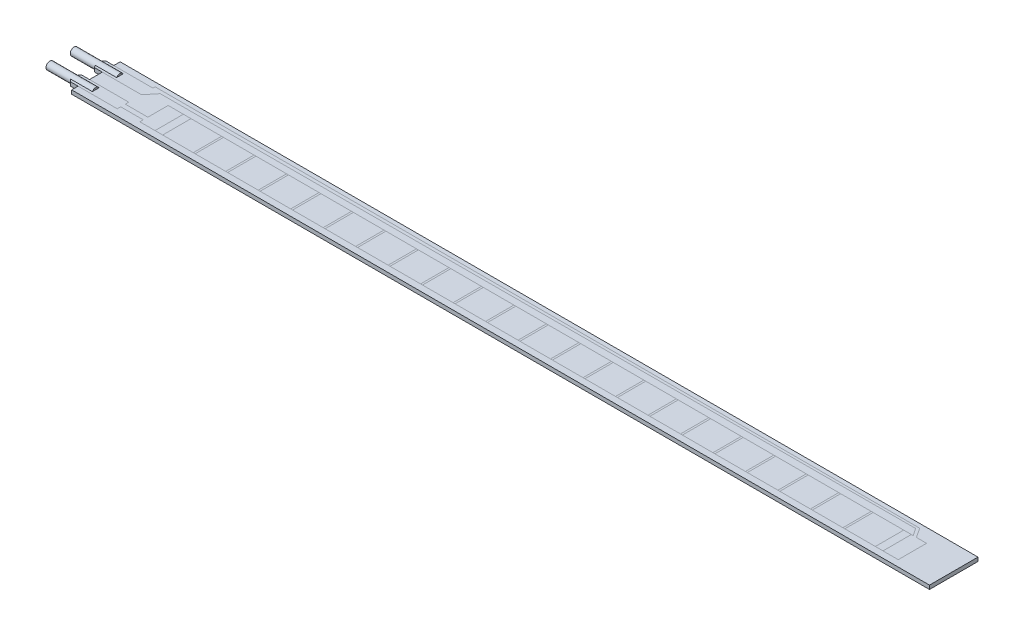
SolidWorks part; units mm, degrees
ref_plane "Front Plane" through (0, 0, 0) normal (0, 0, 1) x (1, 0, 0)
ref_plane "Top Plane" through (0, 0, 0) normal (0, 1, 0) x (1, 0, 0)
ref_plane "Right Plane" through (0, 0, 0) normal (1, 0, 0) x (0, 0, -1)
sketch "Sketch1" plane through (0, 0, 0) normal (0, 1, 0) x (1, 0, 0)
  line L1 (-56.12, -3.175) -> (56.12, -3.175)
  line L2 (-56.12, -3.175) -> (-56.12, 3.175)
  line L3 (-56.12, 3.175) -> (56.12, 3.175)
  line L4 (56.12, -3.175) -> (56.12, 3.175)
  point P0 (0, 0)
  dimension "D1" = 112.24
  dimension "D2" = 6.35
extrude "Boss-Extrude1" add sketch "Sketch1" along normal blind 0.5
sketch "Sketch2" plane through (0, 0.5, 0) normal (0, 1, 0) x (1, 0, 0)
  line L0 (-56.12, 0) -> (-56.12, -3.175) construction
  line L1 (-56.12, 3.175) -> (-56.12, -3.175) construction
  line L2 (-56.12, 0) -> (-56.12, 3.175) construction
  line L3 (-56.12, -2.3375) -> (-50.9922, -2.3375)
  line L4 (-48.0377, -1.2875) -> (-48.0377, 1.3707)
  line L6 (-56.12, -0.8375) -> (-50.9922, -0.8375)
  line L7 (-56.12, 0.8375) -> (-50.9922, 0.8375)
  line L8 (-56.12, 2.3375) -> (-50.9922, 2.3375)
  line L9 (-48.0377, -2.3375) -> (51.1928, -2.3375)
  line L10 (-48.0377, -2.3375) -> (-48.0377, -1.8875)
  line L11 (-48.0377, 1.3707) -> (49.452, 1.3707)
  line L12 (51.1928, -2.3375) -> (51.1928, 1.3707)
  line L13 (-50.9922, 0.8375) -> (-49.8989, 2.1837)
  line L14 (-50.9922, 2.3375) -> (-50.9922, 2.6295)
  line L15 (-50.9922, -1.8875) -> (-48.0377, -1.8875)
  line L16 (-50.9922, -1.2875) -> (-48.0377, -1.2875)
  line L17 (-50.9922, -0.8375) -> (-50.9922, -1.2875)
  line L18 (-50.9922, -2.3375) -> (-50.9922, -1.8875)
  line L19 (-50.9922, 2.6295) -> (49.0295, 2.6295)
  line L21 (49.0295, 2.6295) -> (49.8745, 1.3707)
  line L22 (-49.8989, 2.1837) -> (48.803, 2.3375)
  line L23 (48.803, 2.3375) -> (49.452, 1.3707)
  line L24 (49.8745, 1.3707) -> (51.1928, 1.3707)
  line L26 (-46.0475, -2.3375) -> (49.2025, -2.3375)
  line L27 (-46.0475, -2.3375) -> (-46.0475, 1.3707)
  line L28 (-46.0475, 1.3707) -> (49.2025, 1.3707)
  line L29 (49.2025, -2.3375) -> (49.2025, 1.3707)
  point P26 (1.5775, -0.4834)
  dimension "D3" = 95.25
sketch "Sketch3" plane through (0, 0.5, 0) normal (0, 1, 0) x (1, 0, 0)
  line L0 (-45.0475, 1.3707) -> (-45.0475, -2.3375)
  line L1 (49.2025, 1.3707) -> (-46.0475, 1.3707) construction
  line L2 (-46.0475, -2.3375) -> (49.2025, -2.3375) construction
  line L3 (48.2025, 1.3707) -> (48.2025, -2.3375)
  line L4 (-46.0475, 1.3707) -> (-46.0475, -2.3375) construction
  line L5 (49.2025, -2.3375) -> (49.2025, 1.3707) construction
  dimension "D1" = 1
  dimension "D2" = 1
sketch "Sketch4" plane through (0, 0.5, 0) normal (0, 1, 0) x (1, 0, 0)
  line L0 (-45.0475, -2.3375) -> (48.2025, -2.3375) construction
  line L1 (-45.0475, 1.3707) -> (-41.0475, 1.3707)
  line L2 (-45.0475, 1.3707) -> (-45.0475, -2.3375)
  line L3 (-45.0475, -2.3375) -> (-41.0475, -2.3375)
  line L4 (-41.0475, 1.3707) -> (-41.0475, -2.3375)
  line L11 (-40.7975, 1.3707) -> (-36.7975, 1.3707)
  line L12 (-40.7975, 1.3707) -> (-40.7975, -2.3375)
  line L17 (-40.7975, -2.3375) -> (-36.7975, -2.3375)
  line L18 (-36.7975, 1.3707) -> (-36.7975, -2.3375)
  line L29 (-36.5475, 1.3707) -> (-32.5475, 1.3707)
  line L30 (-36.5475, 1.3707) -> (-36.5475, -2.3375)
  line L35 (-36.5475, -2.3375) -> (-32.5475, -2.3375)
  line L36 (-32.5475, 1.3707) -> (-32.5475, -2.3375)
  line L47 (-32.2975, 1.3707) -> (-28.2975, 1.3707)
  line L48 (-32.2975, 1.3707) -> (-32.2975, -2.3375)
  line L53 (-32.2975, -2.3375) -> (-28.2975, -2.3375)
  line L54 (-28.2975, 1.3707) -> (-28.2975, -2.3375)
  line L65 (-28.0475, 1.3707) -> (-24.0475, 1.3707)
  line L66 (-28.0475, 1.3707) -> (-28.0475, -2.3375)
  line L71 (-28.0475, -2.3375) -> (-24.0475, -2.3375)
  line L72 (-24.0475, 1.3707) -> (-24.0475, -2.3375)
  line L83 (-23.7975, 1.3707) -> (-19.7975, 1.3707)
  line L84 (-23.7975, 1.3707) -> (-23.7975, -2.3375)
  line L89 (-23.7975, -2.3375) -> (-19.7975, -2.3375)
  line L90 (-19.7975, 1.3707) -> (-19.7975, -2.3375)
  line L101 (-19.5475, 1.3707) -> (-15.5475, 1.3707)
  line L102 (-19.5475, 1.3707) -> (-19.5475, -2.3375)
  line L107 (-19.5475, -2.3375) -> (-15.5475, -2.3375)
  line L108 (-15.5475, 1.3707) -> (-15.5475, -2.3375)
  line L119 (-15.2975, 1.3707) -> (-11.2975, 1.3707)
  line L120 (-15.2975, 1.3707) -> (-15.2975, -2.3375)
  line L125 (-15.2975, -2.3375) -> (-11.2975, -2.3375)
  line L126 (-11.2975, 1.3707) -> (-11.2975, -2.3375)
  line L133 (-11.0475, 1.3707) -> (-7.0475, 1.3707)
  line L134 (-11.0475, 1.3707) -> (-11.0475, -2.3375)
  line L135 (-11.0475, -2.3375) -> (-7.0475, -2.3375)
  line L136 (-7.0475, 1.3707) -> (-7.0475, -2.3375)
  line L139 (-6.7975, 1.3707) -> (-2.7975, 1.3707)
  line L140 (-6.7975, 1.3707) -> (-6.7975, -2.3375)
  line L141 (-6.7975, -2.3375) -> (-2.7975, -2.3375)
  line L142 (-2.7975, 1.3707) -> (-2.7975, -2.3375)
  line L145 (-2.5475, 1.3707) -> (1.4525, 1.3707)
  line L146 (-2.5475, 1.3707) -> (-2.5475, -2.3375)
  line L147 (-2.5475, -2.3375) -> (1.4525, -2.3375)
  line L148 (1.4525, 1.3707) -> (1.4525, -2.3375)
  line L151 (1.7025, 1.3707) -> (5.7025, 1.3707)
  line L152 (1.7025, 1.3707) -> (1.7025, -2.3375)
  line L153 (1.7025, -2.3375) -> (5.7025, -2.3375)
  line L154 (5.7025, 1.3707) -> (5.7025, -2.3375)
  line L157 (5.9525, 1.3707) -> (9.9525, 1.3707)
  line L158 (5.9525, 1.3707) -> (5.9525, -2.3375)
  line L159 (5.9525, -2.3375) -> (9.9525, -2.3375)
  line L160 (9.9525, 1.3707) -> (9.9525, -2.3375)
  line L163 (10.2025, 1.3707) -> (14.2025, 1.3707)
  line L164 (10.2025, 1.3707) -> (10.2025, -2.3375)
  line L165 (10.2025, -2.3375) -> (14.2025, -2.3375)
  line L166 (14.2025, 1.3707) -> (14.2025, -2.3375)
  line L169 (14.4525, 1.3707) -> (18.4525, 1.3707)
  line L170 (14.4525, 1.3707) -> (14.4525, -2.3375)
  line L171 (14.4525, -2.3375) -> (18.4525, -2.3375)
  line L172 (18.4525, 1.3707) -> (18.4525, -2.3375)
  line L175 (18.7025, 1.3707) -> (22.7025, 1.3707)
  line L176 (18.7025, 1.3707) -> (18.7025, -2.3375)
  line L177 (18.7025, -2.3375) -> (22.7025, -2.3375)
  line L178 (22.7025, 1.3707) -> (22.7025, -2.3375)
  line L181 (22.9525, 1.3707) -> (26.9525, 1.3707)
  line L182 (22.9525, 1.3707) -> (22.9525, -2.3375)
  line L183 (22.9525, -2.3375) -> (26.9525, -2.3375)
  line L184 (26.9525, 1.3707) -> (26.9525, -2.3375)
  line L187 (27.2025, 1.3707) -> (31.2025, 1.3707)
  line L188 (27.2025, 1.3707) -> (27.2025, -2.3375)
  line L189 (27.2025, -2.3375) -> (31.2025, -2.3375)
  line L190 (31.2025, 1.3707) -> (31.2025, -2.3375)
  line L193 (31.4525, 1.3707) -> (35.4525, 1.3707)
  line L194 (31.4525, 1.3707) -> (31.4525, -2.3375)
  line L195 (31.4525, -2.3375) -> (35.4525, -2.3375)
  line L196 (35.4525, 1.3707) -> (35.4525, -2.3375)
  line L199 (35.7025, 1.3707) -> (39.7025, 1.3707)
  line L200 (35.7025, 1.3707) -> (35.7025, -2.3375)
  line L201 (35.7025, -2.3375) -> (39.7025, -2.3375)
  line L202 (39.7025, 1.3707) -> (39.7025, -2.3375)
  line L205 (39.9525, 1.3707) -> (43.9525, 1.3707)
  line L206 (39.9525, 1.3707) -> (39.9525, -2.3375)
  line L207 (39.9525, -2.3375) -> (43.9525, -2.3375)
  line L208 (43.9525, 1.3707) -> (43.9525, -2.3375)
  line L211 (44.2025, 1.3707) -> (48.2025, 1.3707)
  line L212 (44.2025, 1.3707) -> (44.2025, -2.3375)
  line L213 (44.2025, -2.3375) -> (48.2025, -2.3375)
  line L214 (48.2025, 1.3707) -> (48.2025, -2.3375)
  point P4 (-43.0475, -0.4834)
  point P14 (-38.7975, -0.4834)
  point P19 (-34.5475, -0.4834)
  point P24 (-30.2975, -0.4834)
  point P29 (-26.0475, -0.4834)
  point P34 (-21.7975, -0.4834)
  point P39 (-17.5475, -0.4834)
  point P44 (-13.2975, -0.4834)
  point P49 (-9.0475, -0.4834)
  point P54 (-4.7975, -0.4834)
  point P59 (-0.5475, -0.4834)
  point P64 (3.7025, -0.4834)
  point P69 (7.9525, -0.4834)
  point P74 (12.2025, -0.4834)
  point P79 (16.4525, -0.4834)
  point P84 (20.7025, -0.4834)
  point P89 (24.9525, -0.4834)
  point P94 (29.2025, -0.4834)
  point P99 (33.4525, -0.4834)
  point P104 (37.7025, -0.4834)
  point P109 (41.9525, -0.4834)
  point P114 (46.2025, -0.4834)
  dimension "D2" = 4
  dimension "D1" = 22
sketch "Sketch5" plane through (0, 0.5, 0) normal (0, 1, 0) x (1, 0, 0)
  line L0 (-56.12, -2.3375) -> (-57.1332, -2.3375)
  line L1 (-57.1332, -2.3375) -> (-57.5631, -1.822)
  line L5 (-56.12, -0.8375) -> (-56.12, -2.3375)
  line L6 (-57.1332, -0.8375) -> (-57.5631, -1.353)
  line L7 (-56.12, -0.8375) -> (-57.1332, -0.8375)
  line L8 (-57.5631, -1.353) -> (-57.5631, -1.822)
  line L9 (-56.12, 0) -> (-58.8012, 0) construction
  line L10 (-56.12, 0.8375) -> (-56.12, -0.8375) construction
  line L11 (-57.5631, 1.353) -> (-57.5631, 1.822)
  line L12 (-56.12, 0.8375) -> (-57.1332, 0.8375)
  line L13 (-57.1332, 0.8375) -> (-57.5631, 1.353)
  line L14 (-56.12, 0.8375) -> (-56.12, 2.3375)
  line L15 (-57.1332, 2.3375) -> (-57.5631, 1.822)
  line L16 (-56.12, 2.3375) -> (-57.1332, 2.3375)
extrude "Boss-Extrude2" add sketch "Sketch5" against normal blind 0.5
sketch "Sketch6" plane through (-57.5631, 0, 0) normal (-1, 0, 0) x (0, 0, 1)
  line L3 (0, 0) -> (0, 0.3953) construction
  circle A0 centre (1.5875, 0.25) radius 0.5
  circle A1 centre (-1.5875, 0.25) radius 0.5
  dimension "D1" = 1
extrude "Boss-Extrude3" add sketch "Sketch6" along normal blind 3 and the other way blind 3
